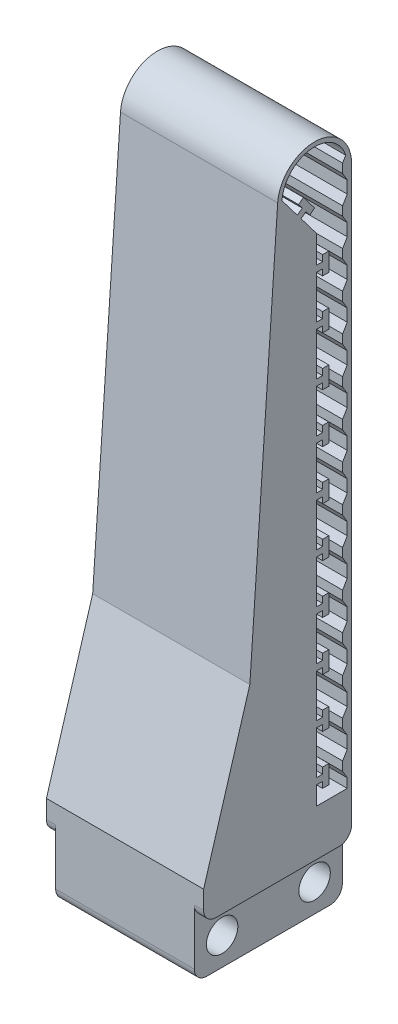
SolidWorks part; units mm, degrees
other "<thumb_base>-<Contouring>"
ref_plane "Front Plane" through (0, 0, 0) normal (0, 0, 1) x (1, 0, 0)
ref_plane "Top Plane" through (0, 0, 0) normal (0, 1, 0) x (1, 0, 0)
ref_plane "Right Plane" through (0, 0, 0) normal (1, 0, 0) x (0, 0, -1)
sketch "Sketch1-thumb_base" plane through (0, 0, 0) normal (0, 0, 1) x (1, 0, 0)
  line L0 (0, 0) -> (0, 18.7675) construction
  line L1 (11.25, 0) -> (-11.25, 0)
  line L2 (-11.25, 0) -> (-11.25, 9)
  line L3 (-11.25, 9) -> (-12.75, 9)
  line L4 (-12.75, 9) -> (-12.75, 14)
  line L5 (12.75, 9) -> (12.75, 14)
  line L6 (11.25, 9) -> (12.75, 9)
  line L7 (11.25, 0) -> (11.25, 9)
  line L8 (-12.75, 14) -> (12.75, 14)
  dimension "D1" = 9
  dimension "D2" = 5
  dimension "D3" = 22.5
  dimension "D4" = 1.5
sketch "Sketch2-thumb_base" plane through (-11.25, 0, 0) normal (-1, 0, 0) x (0, 0, 1)
  line L0 (-12, 4.5) -> (12, 4.5) construction
  line L3 (0, 0) -> (0, 9) construction
  circle A0 centre (-7.5, 4.5) radius 2.55
  circle A1 centre (7.5, 4.5) radius 2.55
  dimension "D2" = 5.1
  dimension "D1" = 15
inserted part "thumb_base"
sketch "Sketch3" plane through (12.75, 0, 0) normal (1, 0, 0) x (0, 0, -1)
  line L0 (12, 14) -> (12, 104)
  line L1 (12, 14) -> (-12, 14)
  line L2 (-12, 14) -> (-4.5, 39)
  line L3 (-4.5, 39) -> (0.0142, 104.4131)
  arc A0 (12, 104) -> (0.0142, 104.4131) centre (6, 104) ccw
  dimension "D2" = 6
  dimension "D1" = 90
  dimension "D3" = 7.5
  dimension "D4" = 25
extrude "Thumb Frame" add sketch "Sketch3" against normal up to surface (25.5 mm away)
sketch "Sketch4" plane through (12.75, 0, 0) normal (1, 0, 0) x (0, 0, -1)
  line L1 (0.7126, 104.3649) -> (6.3, 97)
  line L2 (11.3, 11) -> (11.3, 104)
  line L3 (11.3, 16.5) -> (11.3, 104)
  line L4 (6.3, 97) -> (6.3, 16.5)
  line L5 (6.3, 16.5) -> (11.3, 16.5)
  line L7 (-10, 9) -> (10, 9) construction
  arc A2 (11.3, 104) -> (0.7126, 104.3649) centre (6, 104) ccw
  arc A3 (11.3, 104) -> (0.7126, 104.3649) centre (6, 104) ccw
  dimension "D2" = 5
  dimension "D3" = 7
  dimension "D4" = 7.5
  dimension "D1" = 0.7
extrude "Cavity - Pad" cut sketch "Sketch4" against normal through all
sketch "Sketch5" plane through (12.75, 0, 0) normal (1, 0, 0) x (0, 0, -1)
  line L0 (11.3, 16.5) -> (11.3, 104) construction
  line L1 (11.3, 16.5) -> (11.3, 104) construction
  line L2 (11.3, 18) -> (10.55, 19.2648)
  line L3 (10.55, 19.2648) -> (10.55, 20.7352)
  line L4 (10.55, 20.7352) -> (11.3, 22)
  line L5 (11.3, 22) -> (11.3, 18)
  line L6 (10.55, 26.7352) -> (11.3, 28)
  line L7 (11.3, 28) -> (11.3, 24)
  line L8 (11.3, 24) -> (10.55, 25.2648)
  line L9 (10.55, 25.2648) -> (10.55, 26.7352)
  line L10 (10.55, 32.7352) -> (11.3, 34)
  line L11 (11.3, 34) -> (11.3, 30)
  line L12 (11.3, 30) -> (10.55, 31.2648)
  line L13 (10.55, 31.2648) -> (10.55, 32.7352)
  line L14 (10.55, 38.7352) -> (11.3, 40)
  line L15 (11.3, 40) -> (11.3, 36)
  line L16 (11.3, 36) -> (10.55, 37.2648)
  line L17 (10.55, 37.2648) -> (10.55, 38.7352)
  line L18 (10.55, 44.7352) -> (11.3, 46)
  line L19 (11.3, 46) -> (11.3, 42)
  line L20 (11.3, 42) -> (10.55, 43.2648)
  line L21 (10.55, 43.2648) -> (10.55, 44.7352)
  line L22 (10.55, 50.7352) -> (11.3, 52)
  line L23 (11.3, 52) -> (11.3, 48)
  line L24 (11.3, 48) -> (10.55, 49.2648)
  line L25 (10.55, 49.2648) -> (10.55, 50.7352)
  line L26 (10.55, 56.7352) -> (11.3, 58)
  line L27 (11.3, 58) -> (11.3, 54)
  line L28 (11.3, 54) -> (10.55, 55.2648)
  line L29 (10.55, 55.2648) -> (10.55, 56.7352)
  line L30 (10.55, 62.7352) -> (11.3, 64)
  line L31 (11.3, 64) -> (11.3, 60)
  line L32 (11.3, 60) -> (10.55, 61.2648)
  line L33 (10.55, 61.2648) -> (10.55, 62.7352)
  line L34 (10.55, 68.7352) -> (11.3, 70)
  line L35 (11.3, 70) -> (11.3, 66)
  line L36 (11.3, 66) -> (10.55, 67.2648)
  line L37 (10.55, 67.2648) -> (10.55, 68.7352)
  line L38 (10.55, 74.7352) -> (11.3, 76)
  line L39 (11.3, 76) -> (11.3, 72)
  line L40 (11.3, 72) -> (10.55, 73.2648)
  line L41 (10.55, 73.2648) -> (10.55, 74.7352)
  line L42 (10.55, 80.7352) -> (11.3, 82)
  line L43 (11.3, 82) -> (11.3, 78)
  line L44 (11.3, 78) -> (10.55, 79.2648)
  line L45 (10.55, 79.2648) -> (10.55, 80.7352)
  line L46 (10.55, 86.7352) -> (11.3, 88)
  line L47 (11.3, 88) -> (11.3, 84)
  line L48 (11.3, 84) -> (10.55, 85.2648)
  line L49 (10.55, 85.2648) -> (10.55, 86.7352)
  line L50 (10.55, 92.7352) -> (11.3, 94)
  line L51 (11.3, 94) -> (11.3, 90)
  line L52 (11.3, 90) -> (10.55, 91.2648)
  line L53 (10.55, 91.2648) -> (10.55, 92.7352)
  line L54 (10.55, 98.7352) -> (11.3, 100)
  line L55 (11.3, 100) -> (11.3, 96)
  line L56 (11.3, 96) -> (10.55, 97.2648)
  line L57 (10.55, 97.2648) -> (10.55, 98.7352)
  line L58 (10.55, 104.7352) -> (11.3, 106)
  line L59 (11.3, 106) -> (11.3, 102)
  line L60 (11.3, 102) -> (10.55, 103.2648)
  line L61 (10.55, 103.2648) -> (10.55, 104.7352)
  dimension "D1" = 4
  dimension "D2" = 1.5
  dimension "D3" = 0.75
  dimension "D4" = 15
extrude "Ridges" add sketch "Sketch5" against normal up to surface (25.5 mm away)
sketch "Sketch6" plane through (12.75, 0, 0) normal (1, 0, 0) x (0, 0, -1)
  line L0 (6.3, 19.5) -> (7.3, 19.5)
  line L1 (6.3, 97) -> (6.3, 16.5) construction
  line L2 (7.3, 19.5) -> (7.3, 18.5)
  line L3 (7.3, 18.5) -> (8.3, 18.5)
  line L4 (8.3, 18.5) -> (8.3, 21.5)
  line L5 (8.3, 21.5) -> (7.3, 21.5)
  line L6 (7.3, 21.5) -> (7.3, 20.5)
  line L7 (7.3, 20.5) -> (6.3, 20.5)
  line L8 (6.3, 20.5) -> (6.3, 19.5)
  line L9 (6.3, 28.5) -> (6.3, 27.5)
  line L10 (6.3, 27.5) -> (7.3, 27.5)
  line L11 (7.3, 27.5) -> (7.3, 26.5)
  line L12 (7.3, 26.5) -> (8.3, 26.5)
  line L13 (8.3, 26.5) -> (8.3, 29.5)
  line L14 (8.3, 29.5) -> (7.3, 29.5)
  line L15 (7.3, 29.5) -> (7.3, 28.5)
  line L16 (7.3, 28.5) -> (6.3, 28.5)
  line L17 (6.3, 36.5) -> (6.3, 35.5)
  line L18 (6.3, 35.5) -> (7.3, 35.5)
  line L19 (7.3, 35.5) -> (7.3, 34.5)
  line L20 (7.3, 34.5) -> (8.3, 34.5)
  line L21 (8.3, 34.5) -> (8.3, 37.5)
  line L22 (8.3, 37.5) -> (7.3, 37.5)
  line L23 (7.3, 37.5) -> (7.3, 36.5)
  line L24 (7.3, 36.5) -> (6.3, 36.5)
  line L25 (6.3, 44.5) -> (6.3, 43.5)
  line L26 (6.3, 43.5) -> (7.3, 43.5)
  line L27 (7.3, 43.5) -> (7.3, 42.5)
  line L28 (7.3, 42.5) -> (8.3, 42.5)
  line L29 (8.3, 42.5) -> (8.3, 45.5)
  line L30 (8.3, 45.5) -> (7.3, 45.5)
  line L31 (7.3, 45.5) -> (7.3, 44.5)
  line L32 (7.3, 44.5) -> (6.3, 44.5)
  line L33 (6.3, 52.5) -> (6.3, 51.5)
  line L34 (6.3, 51.5) -> (7.3, 51.5)
  line L35 (7.3, 51.5) -> (7.3, 50.5)
  line L36 (7.3, 50.5) -> (8.3, 50.5)
  line L37 (8.3, 50.5) -> (8.3, 53.5)
  line L38 (8.3, 53.5) -> (7.3, 53.5)
  line L39 (7.3, 53.5) -> (7.3, 52.5)
  line L40 (7.3, 52.5) -> (6.3, 52.5)
  line L41 (6.3, 60.5) -> (6.3, 59.5)
  line L42 (6.3, 59.5) -> (7.3, 59.5)
  line L43 (7.3, 59.5) -> (7.3, 58.5)
  line L44 (7.3, 58.5) -> (8.3, 58.5)
  line L45 (8.3, 58.5) -> (8.3, 61.5)
  line L46 (8.3, 61.5) -> (7.3, 61.5)
  line L47 (7.3, 61.5) -> (7.3, 60.5)
  line L48 (7.3, 60.5) -> (6.3, 60.5)
  line L49 (6.3, 68.5) -> (6.3, 67.5)
  line L50 (6.3, 67.5) -> (7.3, 67.5)
  line L51 (7.3, 67.5) -> (7.3, 66.5)
  line L52 (7.3, 66.5) -> (8.3, 66.5)
  line L53 (8.3, 66.5) -> (8.3, 69.5)
  line L54 (8.3, 69.5) -> (7.3, 69.5)
  line L55 (7.3, 69.5) -> (7.3, 68.5)
  line L56 (7.3, 68.5) -> (6.3, 68.5)
  line L57 (6.3, 76.5) -> (6.3, 75.5)
  line L58 (6.3, 75.5) -> (7.3, 75.5)
  line L59 (7.3, 75.5) -> (7.3, 74.5)
  line L60 (7.3, 74.5) -> (8.3, 74.5)
  line L61 (8.3, 74.5) -> (8.3, 77.5)
  line L62 (8.3, 77.5) -> (7.3, 77.5)
  line L63 (7.3, 77.5) -> (7.3, 76.5)
  line L64 (7.3, 76.5) -> (6.3, 76.5)
  line L65 (6.3, 84.5) -> (6.3, 83.5)
  line L66 (6.3, 83.5) -> (7.3, 83.5)
  line L67 (7.3, 83.5) -> (7.3, 82.5)
  line L68 (7.3, 82.5) -> (8.3, 82.5)
  line L69 (8.3, 82.5) -> (8.3, 85.5)
  line L70 (8.3, 85.5) -> (7.3, 85.5)
  line L71 (7.3, 85.5) -> (7.3, 84.5)
  line L72 (7.3, 84.5) -> (6.3, 84.5)
  line L73 (6.3, 92.5) -> (6.3, 91.5)
  line L74 (6.3, 91.5) -> (7.3, 91.5)
  line L75 (7.3, 91.5) -> (7.3, 90.5)
  line L76 (7.3, 90.5) -> (8.3, 90.5)
  line L77 (8.3, 90.5) -> (8.3, 93.5)
  line L78 (8.3, 93.5) -> (7.3, 93.5)
  line L79 (7.3, 93.5) -> (7.3, 92.5)
  line L80 (7.3, 92.5) -> (6.3, 92.5)
  line L81 (3.5063, 100.6824) -> (5.8442, 102.4561) construction
  line L83 (0.7126, 104.3649) -> (6.3, 97) construction
  line L84 (3.8085, 100.2841) -> (3.2041, 101.0808)
  line L85 (3.2041, 101.0808) -> (4.0008, 101.6852)
  line L86 (4.0008, 101.6852) -> (3.3964, 102.4819)
  line L87 (3.3964, 102.4819) -> (4.193, 103.0863)
  line L88 (4.193, 103.0863) -> (6.0062, 100.6962)
  line L89 (6.0062, 100.6962) -> (5.2096, 100.0918)
  line L90 (5.2096, 100.0918) -> (4.6052, 100.8885)
  line L91 (4.6052, 100.8885) -> (3.8085, 100.2841)
  dimension "D1" = 1
  dimension "D2" = 3
  dimension "D3" = 10
extrude "Pad Hooks" add sketch "Sketch6" against normal up to surface (25.5 mm away)
ref_point "Point1"
sketch "Sketch7" [suppressed] plane through (12.75, 0, 0) normal (1, 0, 0) x (0, 0, -1)
  line L151 (7.3, 19.5) -> (6.3, 19.5)
  line L152 (10.55, 104.7352) -> (11.0562, 105.5889)
  line L153 (10.55, 103.2648) -> (10.55, 104.7352)
  line L154 (11.3, 102) -> (10.55, 103.2648)
  line L155 (11.3, 100) -> (11.3, 102)
  line L156 (10.55, 98.7352) -> (11.3, 100)
  line L157 (10.55, 97.2648) -> (10.55, 98.7352)
  line L158 (11.3, 96) -> (10.55, 97.2648)
  line L159 (11.3, 94) -> (11.3, 96)
  line L160 (10.55, 92.7352) -> (11.3, 94)
  line L161 (10.55, 91.2648) -> (10.55, 92.7352)
  line L162 (11.3, 90) -> (10.55, 91.2648)
  line L163 (11.3, 88) -> (11.3, 90)
  line L164 (10.55, 86.7352) -> (11.3, 88)
  line L165 (10.55, 85.2648) -> (10.55, 86.7352)
  line L166 (11.3, 84) -> (10.55, 85.2648)
  line L167 (11.3, 82) -> (11.3, 84)
  line L168 (10.55, 80.7352) -> (11.3, 82)
  line L169 (10.55, 79.2648) -> (10.55, 80.7352)
  line L170 (11.3, 78) -> (10.55, 79.2648)
  line L171 (11.3, 76) -> (11.3, 78)
  line L172 (10.55, 74.7352) -> (11.3, 76)
  line L173 (10.55, 73.2648) -> (10.55, 74.7352)
  line L174 (11.3, 72) -> (10.55, 73.2648)
  line L175 (11.3, 70) -> (11.3, 72)
  line L176 (10.55, 68.7352) -> (11.3, 70)
  line L177 (10.55, 67.2648) -> (10.55, 68.7352)
  line L178 (11.3, 66) -> (10.55, 67.2648)
  line L179 (11.3, 64) -> (11.3, 66)
  line L180 (10.55, 62.7352) -> (11.3, 64)
  line L181 (10.55, 61.2648) -> (10.55, 62.7352)
  line L182 (11.3, 60) -> (10.55, 61.2648)
  line L183 (11.3, 58) -> (11.3, 60)
  line L184 (10.55, 56.7352) -> (11.3, 58)
  line L185 (10.55, 55.2648) -> (10.55, 56.7352)
  line L186 (11.3, 54) -> (10.55, 55.2648)
  line L187 (11.3, 52) -> (11.3, 54)
  line L188 (10.55, 50.7352) -> (11.3, 52)
  line L189 (10.55, 49.2648) -> (10.55, 50.7352)
  line L190 (11.3, 48) -> (10.55, 49.2648)
  line L191 (11.3, 46) -> (11.3, 48)
  line L192 (10.55, 44.7352) -> (11.3, 46)
  line L193 (10.55, 43.2648) -> (10.55, 44.7352)
  line L194 (11.3, 42) -> (10.55, 43.2648)
  line L195 (11.3, 40) -> (11.3, 42)
  line L196 (10.55, 38.7352) -> (11.3, 40)
  line L197 (10.55, 37.2648) -> (10.55, 38.7352)
  line L198 (11.3, 36) -> (10.55, 37.2648)
  line L199 (11.3, 34) -> (11.3, 36)
  line L200 (10.55, 32.7352) -> (11.3, 34)
  line L201 (10.55, 31.2648) -> (10.55, 32.7352)
  line L202 (11.3, 30) -> (10.55, 31.2648)
  line L203 (11.3, 28) -> (11.3, 30)
  line L204 (10.55, 26.7352) -> (11.3, 28)
  line L205 (10.55, 25.2648) -> (10.55, 26.7352)
  line L206 (11.3, 24) -> (10.55, 25.2648)
  line L207 (11.3, 22) -> (11.3, 24)
  line L208 (10.55, 20.7352) -> (11.3, 22)
  line L209 (10.55, 19.2648) -> (10.55, 20.7352)
  line L210 (11.3, 18) -> (10.55, 19.2648)
  line L211 (11.3, 16.5) -> (11.3, 18)
  line L212 (6.3, 16.5) -> (11.3, 16.5)
  line L213 (6.3, 19.5) -> (6.3, 16.5)
  line L214 (7.3, 19.5) -> (6.3, 19.5)
  line L215 (7.3, 18.5) -> (7.3, 19.5)
  line L216 (7.3, 18.5) -> (7.3, 19.5)
  line L217 (8.3, 18.5) -> (7.3, 18.5)
  line L218 (8.3, 18.5) -> (7.3, 18.5)
  line L219 (8.3, 21.5) -> (8.3, 18.5)
  line L220 (8.3, 21.5) -> (8.3, 18.5)
  line L221 (7.3, 21.5) -> (8.3, 21.5)
  line L222 (7.3, 21.5) -> (8.3, 21.5)
  line L223 (7.3, 20.5) -> (7.3, 21.5)
  line L224 (7.3, 20.5) -> (7.3, 21.5)
  line L225 (6.3, 20.5) -> (7.3, 20.5)
  line L226 (6.3, 20.5) -> (7.3, 20.5)
  line L227 (6.3, 27.5) -> (6.3, 20.5)
  line L228 (6.3, 27.5) -> (6.3, 20.5)
  line L229 (7.3, 27.5) -> (6.3, 27.5)
  line L230 (7.3, 27.5) -> (6.3, 27.5)
  line L231 (7.3, 26.5) -> (7.3, 27.5)
  line L232 (7.3, 26.5) -> (7.3, 27.5)
  line L233 (8.3, 26.5) -> (7.3, 26.5)
  line L234 (8.3, 26.5) -> (7.3, 26.5)
  line L235 (8.3, 29.5) -> (8.3, 26.5)
  line L236 (8.3, 29.5) -> (8.3, 26.5)
  line L237 (7.3, 29.5) -> (8.3, 29.5)
  line L238 (7.3, 29.5) -> (8.3, 29.5)
  line L239 (7.3, 28.5) -> (7.3, 29.5)
  line L240 (7.3, 28.5) -> (7.3, 29.5)
  line L241 (6.3, 28.5) -> (7.3, 28.5)
  line L242 (6.3, 28.5) -> (7.3, 28.5)
  line L243 (6.3, 35.5) -> (6.3, 28.5)
  line L244 (6.3, 35.5) -> (6.3, 28.5)
  line L245 (7.3, 35.5) -> (6.3, 35.5)
  line L246 (7.3, 35.5) -> (6.3, 35.5)
  line L247 (7.3, 34.5) -> (7.3, 35.5)
  line L248 (7.3, 34.5) -> (7.3, 35.5)
  line L249 (8.3, 34.5) -> (7.3, 34.5)
  line L250 (8.3, 34.5) -> (7.3, 34.5)
  line L251 (8.3, 37.5) -> (8.3, 34.5)
  line L252 (8.3, 37.5) -> (8.3, 34.5)
  line L253 (7.3, 37.5) -> (8.3, 37.5)
  line L254 (7.3, 37.5) -> (8.3, 37.5)
  line L255 (7.3, 36.5) -> (7.3, 37.5)
  line L256 (7.3, 36.5) -> (7.3, 37.5)
  line L257 (6.3, 36.5) -> (7.3, 36.5)
  line L258 (6.3, 36.5) -> (7.3, 36.5)
  line L259 (6.3, 43.5) -> (6.3, 36.5)
  line L260 (6.3, 43.5) -> (6.3, 36.5)
  line L261 (7.3, 43.5) -> (6.3, 43.5)
  line L262 (7.3, 43.5) -> (6.3, 43.5)
  line L263 (7.3, 42.5) -> (7.3, 43.5)
  line L264 (7.3, 42.5) -> (7.3, 43.5)
  line L265 (8.3, 42.5) -> (7.3, 42.5)
  line L266 (8.3, 42.5) -> (7.3, 42.5)
  line L267 (8.3, 45.5) -> (8.3, 42.5)
  line L268 (8.3, 45.5) -> (8.3, 42.5)
  line L269 (7.3, 45.5) -> (8.3, 45.5)
  line L270 (7.3, 45.5) -> (8.3, 45.5)
  line L271 (7.3, 44.5) -> (7.3, 45.5)
  line L272 (7.3, 44.5) -> (7.3, 45.5)
  line L273 (6.3, 44.5) -> (7.3, 44.5)
  line L274 (6.3, 44.5) -> (7.3, 44.5)
  line L275 (6.3, 51.5) -> (6.3, 44.5)
  line L276 (6.3, 51.5) -> (6.3, 44.5)
  line L277 (7.3, 51.5) -> (6.3, 51.5)
  line L278 (7.3, 51.5) -> (6.3, 51.5)
  line L279 (7.3, 50.5) -> (7.3, 51.5)
  line L280 (7.3, 50.5) -> (7.3, 51.5)
  line L281 (8.3, 50.5) -> (7.3, 50.5)
  line L282 (8.3, 50.5) -> (7.3, 50.5)
  line L283 (8.3, 53.5) -> (8.3, 50.5)
  line L284 (8.3, 53.5) -> (8.3, 50.5)
  line L285 (7.3, 53.5) -> (8.3, 53.5)
  line L286 (7.3, 53.5) -> (8.3, 53.5)
  line L287 (7.3, 52.5) -> (7.3, 53.5)
  line L288 (7.3, 52.5) -> (7.3, 53.5)
  line L289 (6.3, 52.5) -> (7.3, 52.5)
  line L290 (6.3, 52.5) -> (7.3, 52.5)
  line L291 (6.3, 59.5) -> (6.3, 52.5)
  line L292 (6.3, 59.5) -> (6.3, 52.5)
  line L293 (7.3, 59.5) -> (6.3, 59.5)
  line L294 (3.8085, 100.2841) -> (6.3, 97)
  line L295 (7.3, 59.5) -> (6.3, 59.5)
  line L296 (7.3, 58.5) -> (7.3, 59.5)
  line L297 (7.3, 58.5) -> (7.3, 59.5)
  line L298 (8.3, 58.5) -> (7.3, 58.5)
  line L299 (8.3, 58.5) -> (7.3, 58.5)
  line L300 (8.3, 61.5) -> (8.3, 58.5)
  line L301 (8.3, 61.5) -> (8.3, 58.5)
  line L302 (7.3, 61.5) -> (8.3, 61.5)
  line L303 (10.55, 104.7352) -> (11.0562, 105.5889)
  line L304 (10.55, 103.2648) -> (10.55, 104.7352)
  line L305 (11.3, 102) -> (10.55, 103.2648)
  line L306 (11.3, 100) -> (11.3, 102)
  line L307 (10.55, 98.7352) -> (11.3, 100)
  line L308 (10.55, 97.2648) -> (10.55, 98.7352)
  line L309 (11.3, 96) -> (10.55, 97.2648)
  line L310 (11.3, 94) -> (11.3, 96)
  line L311 (10.55, 92.7352) -> (11.3, 94)
  line L312 (10.55, 91.2648) -> (10.55, 92.7352)
  line L313 (11.3, 90) -> (10.55, 91.2648)
  line L314 (11.3, 88) -> (11.3, 90)
  line L315 (10.55, 86.7352) -> (11.3, 88)
  line L316 (10.55, 85.2648) -> (10.55, 86.7352)
  line L317 (11.3, 84) -> (10.55, 85.2648)
  line L318 (11.3, 82) -> (11.3, 84)
  line L319 (10.55, 80.7352) -> (11.3, 82)
  line L320 (10.55, 79.2648) -> (10.55, 80.7352)
  line L321 (11.3, 78) -> (10.55, 79.2648)
  line L322 (11.3, 76) -> (11.3, 78)
  line L323 (10.55, 74.7352) -> (11.3, 76)
  line L324 (10.55, 73.2648) -> (10.55, 74.7352)
  line L325 (11.3, 72) -> (10.55, 73.2648)
  line L326 (11.3, 70) -> (11.3, 72)
  line L327 (10.55, 68.7352) -> (11.3, 70)
  line L328 (10.55, 67.2648) -> (10.55, 68.7352)
  line L329 (11.3, 66) -> (10.55, 67.2648)
  line L330 (11.3, 64) -> (11.3, 66)
  line L331 (10.55, 62.7352) -> (11.3, 64)
  line L332 (10.55, 61.2648) -> (10.55, 62.7352)
  line L333 (11.3, 60) -> (10.55, 61.2648)
  line L334 (11.3, 58) -> (11.3, 60)
  line L335 (10.55, 56.7352) -> (11.3, 58)
  line L336 (10.55, 55.2648) -> (10.55, 56.7352)
  line L337 (11.3, 54) -> (10.55, 55.2648)
  line L338 (11.3, 52) -> (11.3, 54)
  line L339 (10.55, 50.7352) -> (11.3, 52)
  line L340 (10.55, 49.2648) -> (10.55, 50.7352)
  line L341 (11.3, 48) -> (10.55, 49.2648)
  line L342 (11.3, 46) -> (11.3, 48)
  line L343 (10.55, 44.7352) -> (11.3, 46)
  line L344 (10.55, 43.2648) -> (10.55, 44.7352)
  line L345 (11.3, 42) -> (10.55, 43.2648)
  line L346 (11.3, 40) -> (11.3, 42)
  line L347 (10.55, 38.7352) -> (11.3, 40)
  line L348 (10.55, 37.2648) -> (10.55, 38.7352)
  line L349 (11.3, 36) -> (10.55, 37.2648)
  line L350 (11.3, 34) -> (11.3, 36)
  line L351 (10.55, 32.7352) -> (11.3, 34)
  line L352 (10.55, 31.2648) -> (10.55, 32.7352)
  line L353 (11.3, 30) -> (10.55, 31.2648)
  line L354 (11.3, 28) -> (11.3, 30)
  line L355 (10.55, 26.7352) -> (11.3, 28)
  line L356 (10.55, 25.2648) -> (10.55, 26.7352)
  line L357 (11.3, 24) -> (10.55, 25.2648)
  line L358 (11.3, 22) -> (11.3, 24)
  line L359 (10.55, 20.7352) -> (11.3, 22)
  line L360 (10.55, 19.2648) -> (10.55, 20.7352)
  line L361 (11.3, 18) -> (10.55, 19.2648)
  line L362 (11.3, 16.5) -> (11.3, 18)
  line L363 (6.3, 16.5) -> (11.3, 16.5)
  line L364 (6.3, 19.5) -> (6.3, 16.5)
  line L365 (7.3, 61.5) -> (8.3, 61.5)
  line L366 (7.3, 60.5) -> (7.3, 61.5)
  line L367 (7.3, 60.5) -> (7.3, 61.5)
  line L368 (6.3, 60.5) -> (7.3, 60.5)
  line L369 (6.3, 60.5) -> (7.3, 60.5)
  line L370 (6.3, 67.5) -> (6.3, 60.5)
  line L371 (6.3, 67.5) -> (6.3, 60.5)
  line L372 (7.3, 67.5) -> (6.3, 67.5)
  line L373 (7.3, 67.5) -> (6.3, 67.5)
  line L374 (7.3, 66.5) -> (7.3, 67.5)
  line L375 (7.3, 66.5) -> (7.3, 67.5)
  line L376 (8.3, 66.5) -> (7.3, 66.5)
  line L377 (8.3, 66.5) -> (7.3, 66.5)
  line L378 (8.3, 69.5) -> (8.3, 66.5)
  line L379 (8.3, 69.5) -> (8.3, 66.5)
  line L380 (7.3, 69.5) -> (8.3, 69.5)
  line L381 (7.3, 69.5) -> (8.3, 69.5)
  line L382 (7.3, 68.5) -> (7.3, 69.5)
  line L383 (7.3, 68.5) -> (7.3, 69.5)
  line L384 (6.3, 68.5) -> (7.3, 68.5)
  line L385 (6.3, 68.5) -> (7.3, 68.5)
  line L386 (6.3, 75.5) -> (6.3, 68.5)
  line L387 (6.3, 75.5) -> (6.3, 68.5)
  line L388 (7.3, 75.5) -> (6.3, 75.5)
  line L389 (7.3, 75.5) -> (6.3, 75.5)
  line L390 (7.3, 74.5) -> (7.3, 75.5)
  line L391 (7.3, 74.5) -> (7.3, 75.5)
  line L392 (8.3, 74.5) -> (7.3, 74.5)
  line L393 (8.3, 74.5) -> (7.3, 74.5)
  line L394 (8.3, 77.5) -> (8.3, 74.5)
  line L395 (8.3, 77.5) -> (8.3, 74.5)
  line L396 (7.3, 77.5) -> (8.3, 77.5)
  line L397 (7.3, 77.5) -> (8.3, 77.5)
  line L398 (7.3, 76.5) -> (7.3, 77.5)
  line L399 (7.3, 76.5) -> (7.3, 77.5)
  line L400 (6.3, 76.5) -> (7.3, 76.5)
  line L401 (6.3, 76.5) -> (7.3, 76.5)
  line L402 (6.3, 83.5) -> (6.3, 76.5)
  line L403 (6.3, 83.5) -> (6.3, 76.5)
  line L404 (7.3, 83.5) -> (6.3, 83.5)
  line L405 (7.3, 83.5) -> (6.3, 83.5)
  line L406 (7.3, 82.5) -> (7.3, 83.5)
  line L407 (7.3, 82.5) -> (7.3, 83.5)
  line L408 (8.3, 82.5) -> (7.3, 82.5)
  line L409 (8.3, 82.5) -> (7.3, 82.5)
  line L410 (8.3, 85.5) -> (8.3, 82.5)
  line L411 (8.3, 85.5) -> (8.3, 82.5)
  line L412 (7.3, 85.5) -> (8.3, 85.5)
  line L413 (7.3, 85.5) -> (8.3, 85.5)
  line L414 (7.3, 84.5) -> (7.3, 85.5)
  line L415 (7.3, 84.5) -> (7.3, 85.5)
  line L416 (6.3, 84.5) -> (7.3, 84.5)
  line L417 (6.3, 84.5) -> (7.3, 84.5)
  line L418 (6.3, 91.5) -> (6.3, 84.5)
  line L419 (6.3, 91.5) -> (6.3, 84.5)
  line L420 (7.3, 91.5) -> (6.3, 91.5)
  line L421 (7.3, 91.5) -> (6.3, 91.5)
  line L422 (7.3, 90.5) -> (7.3, 91.5)
  line L423 (7.3, 90.5) -> (7.3, 91.5)
  line L424 (8.3, 90.5) -> (7.3, 90.5)
  line L425 (8.3, 90.5) -> (7.3, 90.5)
  line L426 (8.3, 93.5) -> (8.3, 90.5)
  line L427 (8.3, 93.5) -> (8.3, 90.5)
  line L428 (7.3, 93.5) -> (8.3, 93.5)
  line L429 (7.3, 93.5) -> (8.3, 93.5)
  line L430 (7.3, 92.5) -> (7.3, 93.5)
  line L431 (7.3, 92.5) -> (7.3, 93.5)
  line L432 (6.3, 92.5) -> (7.3, 92.5)
  line L433 (6.3, 92.5) -> (7.3, 92.5)
  line L434 (6.3, 97) -> (6.3, 92.5)
  line L435 (6.3, 97) -> (6.3, 92.5)
  line L436 (4.6052, 100.8885) -> (3.8085, 100.2841)
  line L437 (4.6052, 100.8885) -> (3.8085, 100.2841)
  line L438 (5.2096, 100.0918) -> (4.6052, 100.8885)
  line L439 (5.2096, 100.0918) -> (4.6052, 100.8885)
  line L440 (6.0062, 100.6962) -> (5.2096, 100.0918)
  line L441 (6.0062, 100.6962) -> (5.2096, 100.0918)
  line L442 (4.193, 103.0863) -> (6.0062, 100.6962)
  line L443 (4.193, 103.0863) -> (6.0062, 100.6962)
  line L444 (3.3964, 102.4819) -> (4.193, 103.0863)
  line L445 (3.8085, 100.2841) -> (6.3, 97)
  line L446 (3.3964, 102.4819) -> (4.193, 103.0863)
  line L447 (4.0008, 101.6852) -> (3.3964, 102.4819)
  line L448 (4.0008, 101.6852) -> (3.3964, 102.4819)
  line L449 (3.2041, 101.0808) -> (4.0008, 101.6852)
  line L450 (3.2041, 101.0808) -> (4.0008, 101.6852)
  line L451 (0.7126, 104.3649) -> (3.2041, 101.0808)
  line L452 (0.7126, 104.3649) -> (3.2041, 101.0808)
  arc A1 (11.0562, 105.5889) -> (0.7126, 104.3649) centre (6, 104) ccw
  arc A2 (11.0562, 105.5889) -> (0.7126, 104.3649) centre (6, 104) ccw
  dimension "D1" = 0
extrude "Pad Material" [suppressed] add sketch "Sketch7" against normal up to surface (25.5 mm away) separate body
sketch "Sketch8" [suppressed] plane through (12.75, 0, 0) normal (1, 0, 0) x (0, 0, -1)
  line L0 (11.3, 16.5) -> (12, 16.5)
  line L1 (12, 11) -> (12, 104) construction
  line L2 (12, 16.5) -> (12, 104)
  line L3 (0.0142, 104.4131) -> (0.7126, 104.3649)
  line L4 (11.3, 16.5) -> (11.3, 18) construction
  line L5 (11.3, 16.5) -> (11.3, 18)
  line L157 (0.7126, 104.3649) -> (3.2041, 101.0808)
  line L158 (3.2041, 101.0808) -> (4.0008, 101.6852)
  line L159 (4.0008, 101.6852) -> (3.3964, 102.4819)
  line L160 (3.3964, 102.4819) -> (4.193, 103.0863)
  line L161 (4.193, 103.0863) -> (6.0062, 100.6962)
  line L162 (6.0062, 100.6962) -> (5.2096, 100.0918)
  line L163 (5.2096, 100.0918) -> (4.6052, 100.8885)
  line L164 (4.6052, 100.8885) -> (3.8085, 100.2841)
  line L165 (3.8085, 100.2841) -> (6.3, 97)
  line L166 (6.3, 97) -> (6.3, 92.5)
  line L167 (6.3, 92.5) -> (7.3, 92.5)
  line L168 (7.3, 92.5) -> (7.3, 93.5)
  line L169 (7.3, 93.5) -> (8.3, 93.5)
  line L170 (8.3, 93.5) -> (8.3, 90.5)
  line L171 (8.3, 90.5) -> (7.3, 90.5)
  line L172 (7.3, 90.5) -> (7.3, 91.5)
  line L173 (7.3, 91.5) -> (6.3, 91.5)
  line L174 (6.3, 91.5) -> (6.3, 84.5)
  line L175 (6.3, 84.5) -> (7.3, 84.5)
  line L176 (7.3, 84.5) -> (7.3, 85.5)
  line L177 (7.3, 85.5) -> (8.3, 85.5)
  line L178 (8.3, 85.5) -> (8.3, 82.5)
  line L179 (8.3, 82.5) -> (7.3, 82.5)
  line L180 (7.3, 82.5) -> (7.3, 83.5)
  line L181 (7.3, 83.5) -> (6.3, 83.5)
  line L182 (6.3, 83.5) -> (6.3, 76.5)
  line L183 (6.3, 76.5) -> (7.3, 76.5)
  line L184 (7.3, 76.5) -> (7.3, 77.5)
  line L185 (7.3, 77.5) -> (8.3, 77.5)
  line L186 (8.3, 77.5) -> (8.3, 74.5)
  line L187 (8.3, 74.5) -> (7.3, 74.5)
  line L188 (7.3, 74.5) -> (7.3, 75.5)
  line L189 (7.3, 75.5) -> (6.3, 75.5)
  line L190 (6.3, 75.5) -> (6.3, 68.5)
  line L191 (6.3, 68.5) -> (7.3, 68.5)
  line L192 (7.3, 68.5) -> (7.3, 69.5)
  line L193 (7.3, 69.5) -> (8.3, 69.5)
  line L194 (8.3, 69.5) -> (8.3, 66.5)
  line L195 (8.3, 66.5) -> (7.3, 66.5)
  line L196 (7.3, 66.5) -> (7.3, 67.5)
  line L197 (7.3, 67.5) -> (6.3, 67.5)
  line L198 (6.3, 67.5) -> (6.3, 60.5)
  line L199 (6.3, 60.5) -> (7.3, 60.5)
  line L200 (7.3, 60.5) -> (7.3, 61.5)
  line L201 (7.3, 61.5) -> (8.3, 61.5)
  line L202 (8.3, 61.5) -> (8.3, 58.5)
  line L203 (8.3, 58.5) -> (7.3, 58.5)
  line L204 (7.3, 58.5) -> (7.3, 59.5)
  line L205 (7.3, 59.5) -> (6.3, 59.5)
  line L206 (6.3, 59.5) -> (6.3, 52.5)
  line L207 (6.3, 59.5) -> (6.3, 52.5)
  line L208 (6.3, 52.5) -> (7.3, 52.5)
  line L209 (7.3, 52.5) -> (7.3, 53.5)
  line L210 (7.3, 53.5) -> (8.3, 53.5)
  line L211 (8.3, 53.5) -> (8.3, 50.5)
  line L212 (8.3, 50.5) -> (7.3, 50.5)
  line L213 (7.3, 50.5) -> (7.3, 51.5)
  line L214 (7.3, 51.5) -> (6.3, 51.5)
  line L215 (6.3, 51.5) -> (6.3, 44.5)
  line L216 (6.3, 44.5) -> (7.3, 44.5)
  line L217 (7.3, 44.5) -> (7.3, 45.5)
  line L218 (7.3, 45.5) -> (8.3, 45.5)
  line L219 (8.3, 45.5) -> (8.3, 42.5)
  line L220 (8.3, 42.5) -> (7.3, 42.5)
  line L221 (7.3, 42.5) -> (7.3, 43.5)
  line L222 (7.3, 43.5) -> (6.3, 43.5)
  line L223 (6.3, 43.5) -> (6.3, 36.5)
  line L224 (6.3, 36.5) -> (7.3, 36.5)
  line L225 (7.3, 36.5) -> (7.3, 37.5)
  line L226 (7.3, 37.5) -> (8.3, 37.5)
  line L227 (8.3, 37.5) -> (8.3, 34.5)
  line L228 (8.3, 34.5) -> (7.3, 34.5)
  line L229 (7.3, 34.5) -> (7.3, 35.5)
  line L230 (7.3, 35.5) -> (6.3, 35.5)
  line L231 (6.3, 35.5) -> (6.3, 28.5)
  line L232 (6.3, 28.5) -> (7.3, 28.5)
  line L233 (7.3, 28.5) -> (7.3, 29.5)
  line L234 (7.3, 29.5) -> (8.3, 29.5)
  line L235 (8.3, 29.5) -> (8.3, 26.5)
  line L236 (8.3, 26.5) -> (7.3, 26.5)
  line L237 (7.3, 26.5) -> (7.3, 27.5)
  line L238 (7.3, 27.5) -> (6.3, 27.5)
  line L239 (6.3, 27.5) -> (6.3, 20.5)
  line L240 (6.3, 20.5) -> (7.3, 20.5)
  line L241 (7.3, 20.5) -> (7.3, 21.5)
  line L242 (7.3, 21.5) -> (8.3, 21.5)
  line L243 (8.3, 21.5) -> (8.3, 18.5)
  line L244 (8.3, 18.5) -> (7.3, 18.5)
  line L245 (7.3, 18.5) -> (7.3, 19.5)
  line L246 (6.3, 19.5) -> (6.3, 16.5)
  line L247 (6.3, 16.5) -> (11.3, 16.5)
  line L248 (11.3, 16.5) -> (11.3, 18)
  line L249 (11.3, 18) -> (10.55, 19.2648)
  line L250 (10.55, 19.2648) -> (10.55, 20.7352)
  line L251 (10.55, 20.7352) -> (11.3, 22)
  line L252 (11.3, 22) -> (11.3, 24)
  line L253 (11.3, 24) -> (10.55, 25.2648)
  line L254 (10.55, 25.2648) -> (10.55, 26.7352)
  line L255 (10.55, 26.7352) -> (11.3, 28)
  line L256 (11.3, 28) -> (11.3, 30)
  line L257 (11.3, 30) -> (10.55, 31.2648)
  line L258 (10.55, 31.2648) -> (10.55, 32.7352)
  line L259 (10.55, 32.7352) -> (11.3, 34)
  line L260 (11.3, 34) -> (11.3, 36)
  line L261 (11.3, 36) -> (10.55, 37.2648)
  line L262 (10.55, 37.2648) -> (10.55, 38.7352)
  line L263 (10.55, 38.7352) -> (11.3, 40)
  line L264 (11.3, 40) -> (11.3, 42)
  line L265 (11.3, 42) -> (10.55, 43.2648)
  line L266 (10.55, 43.2648) -> (10.55, 44.7352)
  line L267 (10.55, 44.7352) -> (11.3, 46)
  line L268 (11.3, 46) -> (11.3, 48)
  line L269 (11.3, 48) -> (10.55, 49.2648)
  line L270 (10.55, 49.2648) -> (10.55, 50.7352)
  line L271 (10.55, 50.7352) -> (11.3, 52)
  line L272 (11.3, 52) -> (11.3, 54)
  line L273 (11.3, 54) -> (10.55, 55.2648)
  line L274 (10.55, 55.2648) -> (10.55, 56.7352)
  line L275 (10.55, 56.7352) -> (11.3, 58)
  line L276 (11.3, 58) -> (11.3, 60)
  line L277 (11.3, 60) -> (10.55, 61.2648)
  line L278 (10.55, 61.2648) -> (10.55, 62.7352)
  line L279 (10.55, 62.7352) -> (11.3, 64)
  line L280 (11.3, 64) -> (11.3, 66)
  line L281 (11.3, 66) -> (10.55, 67.2648)
  line L282 (10.55, 67.2648) -> (10.55, 68.7352)
  line L283 (10.55, 68.7352) -> (11.3, 70)
  line L284 (11.3, 70) -> (11.3, 72)
  line L285 (11.3, 72) -> (10.55, 73.2648)
  line L286 (10.55, 73.2648) -> (10.55, 74.7352)
  line L287 (10.55, 74.7352) -> (11.3, 76)
  line L288 (11.3, 76) -> (11.3, 78)
  line L289 (11.3, 78) -> (10.55, 79.2648)
  line L290 (10.55, 79.2648) -> (10.55, 80.7352)
  line L291 (10.55, 80.7352) -> (11.3, 82)
  line L292 (11.3, 82) -> (11.3, 84)
  line L293 (11.3, 84) -> (10.55, 85.2648)
  line L294 (10.55, 85.2648) -> (10.55, 86.7352)
  line L295 (10.55, 86.7352) -> (11.3, 88)
  line L296 (11.3, 88) -> (11.3, 90)
  line L297 (11.3, 90) -> (10.55, 91.2648)
  line L298 (10.55, 91.2648) -> (10.55, 92.7352)
  line L299 (10.55, 92.7352) -> (11.3, 94)
  line L300 (11.3, 94) -> (11.3, 96)
  line L301 (11.3, 96) -> (10.55, 97.2648)
  line L302 (10.55, 97.2648) -> (10.55, 98.7352)
  line L303 (10.55, 98.7352) -> (11.3, 100)
  line L304 (11.3, 100) -> (11.3, 102)
  line L305 (11.3, 102) -> (10.55, 103.2648)
  line L306 (10.55, 103.2648) -> (10.55, 104.7352)
  line L307 (10.55, 104.7352) -> (11.0562, 105.5889)
  line L308 (7.3, 19.5) -> (6.3, 19.5)
  line L399 (11.3, 16.5) -> (11.3, 18)
  line L400 (11.3, 18) -> (10.55, 19.2648)
  line L401 (10.55, 19.2648) -> (10.55, 20.7352)
  line L402 (10.55, 20.7352) -> (11.3, 22)
  line L403 (11.3, 22) -> (11.3, 24)
  line L404 (11.3, 24) -> (10.55, 25.2648)
  line L405 (10.55, 25.2648) -> (10.55, 26.7352)
  line L406 (10.55, 26.7352) -> (11.3, 28)
  line L407 (11.3, 28) -> (11.3, 30)
  line L408 (11.3, 30) -> (10.55, 31.2648)
  line L409 (10.55, 31.2648) -> (10.55, 32.7352)
  line L410 (10.55, 32.7352) -> (11.3, 34)
  line L411 (11.3, 34) -> (11.3, 36)
  line L412 (11.3, 36) -> (10.55, 37.2648)
  line L413 (10.55, 37.2648) -> (10.55, 38.7352)
  line L414 (10.55, 38.7352) -> (11.3, 40)
  line L415 (11.3, 40) -> (11.3, 42)
  line L416 (11.3, 42) -> (10.55, 43.2648)
  line L417 (10.55, 43.2648) -> (10.55, 44.7352)
  line L418 (10.55, 44.7352) -> (11.3, 46)
  line L419 (11.3, 46) -> (11.3, 48)
  line L420 (11.3, 48) -> (10.55, 49.2648)
  line L421 (10.55, 49.2648) -> (10.55, 50.7352)
  line L422 (10.55, 50.7352) -> (11.3, 52)
  line L423 (11.3, 52) -> (11.3, 54)
  line L424 (11.3, 54) -> (10.55, 55.2648)
  line L425 (10.55, 55.2648) -> (10.55, 56.7352)
  line L426 (10.55, 56.7352) -> (11.3, 58)
  line L427 (11.3, 58) -> (11.3, 60)
  line L428 (11.3, 60) -> (10.55, 61.2648)
  line L429 (10.55, 61.2648) -> (10.55, 62.7352)
  line L430 (10.55, 62.7352) -> (11.3, 64)
  line L431 (11.3, 64) -> (11.3, 66)
  line L432 (11.3, 66) -> (10.55, 67.2648)
  line L433 (10.55, 67.2648) -> (10.55, 68.7352)
  line L434 (10.55, 68.7352) -> (11.3, 70)
  line L435 (11.3, 70) -> (11.3, 72)
  line L436 (11.3, 72) -> (10.55, 73.2648)
  line L437 (10.55, 73.2648) -> (10.55, 74.7352)
  line L438 (10.55, 74.7352) -> (11.3, 76)
  line L439 (11.3, 76) -> (11.3, 78)
  line L440 (11.3, 78) -> (10.55, 79.2648)
  line L441 (10.55, 79.2648) -> (10.55, 80.7352)
  line L442 (10.55, 80.7352) -> (11.3, 82)
  line L443 (11.3, 82) -> (11.3, 84)
  line L444 (11.3, 84) -> (10.55, 85.2648)
  line L445 (10.55, 85.2648) -> (10.55, 86.7352)
  line L446 (10.55, 86.7352) -> (11.3, 88)
  line L447 (11.3, 88) -> (11.3, 90)
  line L448 (11.3, 90) -> (10.55, 91.2648)
  line L449 (10.55, 91.2648) -> (10.55, 92.7352)
  line L450 (10.55, 92.7352) -> (11.3, 94)
  line L451 (11.3, 94) -> (11.3, 96)
  line L452 (11.3, 96) -> (10.55, 97.2648)
  line L453 (10.55, 97.2648) -> (10.55, 98.7352)
  line L454 (10.55, 98.7352) -> (11.3, 100)
  line L455 (11.3, 100) -> (11.3, 102)
  line L456 (11.3, 102) -> (10.55, 103.2648)
  line L457 (10.55, 103.2648) -> (10.55, 104.7352)
  line L458 (10.55, 104.7352) -> (11.0562, 105.5889)
  arc A0 (12, 104) -> (0.0142, 104.4131) centre (6, 104) ccw construction
  arc A1 (12, 104) -> (0.0142, 104.4131) centre (6, 104) ccw
  arc A2 (11.0562, 105.5889) -> (0.7126, 104.3649) centre (6, 104) ccw construction
  arc A3 (11.0562, 105.5889) -> (0.7126, 104.3649) centre (6, 104) ccw
  arc A5 (11.0562, 105.5889) -> (0.7126, 104.3649) centre (6, 104) ccw
  arc A6 (11.0562, 105.5889) -> (0.7126, 104.3649) centre (6, 104) ccw
  dimension "D1" = 0
extrude "Wall Removal" [suppressed] cut sketch "Sketch8" against normal through all contours A3 L458 L457 L456 L455 L454 L453 L452 L451 L450 L449 L448 L447 L446 L445 L444 L443 L442 L441 L440 L439 L438 L437 L436 L435 L434 L433 L432 L431 L430 L429 L428 L427 L426 L425 L424 L423 L422 L421 L420 L419 L418 L417 L416 L415 L414 L413 L412 L411 L410 L409
